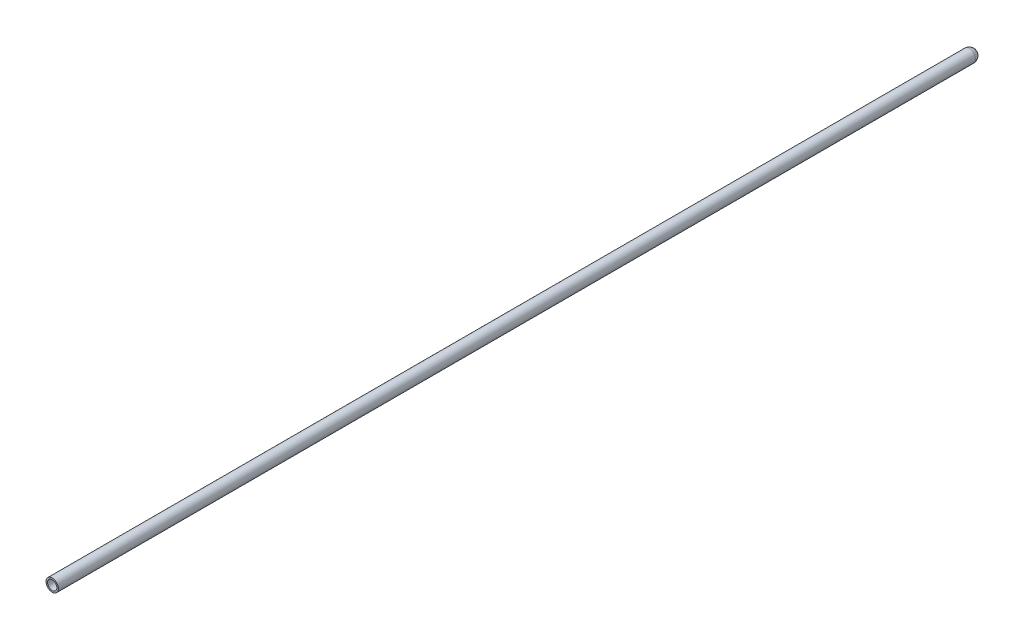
SolidWorks part; units mm, degrees
ref_plane "Front Plane" through (0, 0, 0) normal (0, 0, 1) x (1, 0, 0)
ref_plane "Top Plane" through (0, 0, 0) normal (0, 1, 0) x (1, 0, 0)
ref_plane "Right Plane" through (0, 0, 0) normal (1, 0, 0) x (0, 0, -1)
sketch "Sketch3" plane through (0, 0, 0) normal (1, 0, 0) x (0, 0, -1)
  line L0 (0, 0) -> (108.3365, 0) construction
  line L1 (0, 1.5) -> (0, 2)
  line L2 (0, 2) -> (295.1692, 2)
  line L3 (297.1692, 0) -> (296.6692, 0)
  line L4 (0, 1.5) -> (295.1692, 1.5)
  arc A0 (295.1692, 2) -> (297.1692, 0) centre (295.1692, 0) cw
  arc A1 (295.1692, 1.5) -> (296.6692, 0) centre (295.1692, 0) cw
  dimension "D1" = 4
  dimension "D2" = 0.5
revolve "Revolve1" add sketch "Sketch3" angle 360 about L0
imported_body "Imported1" [suppressed]
